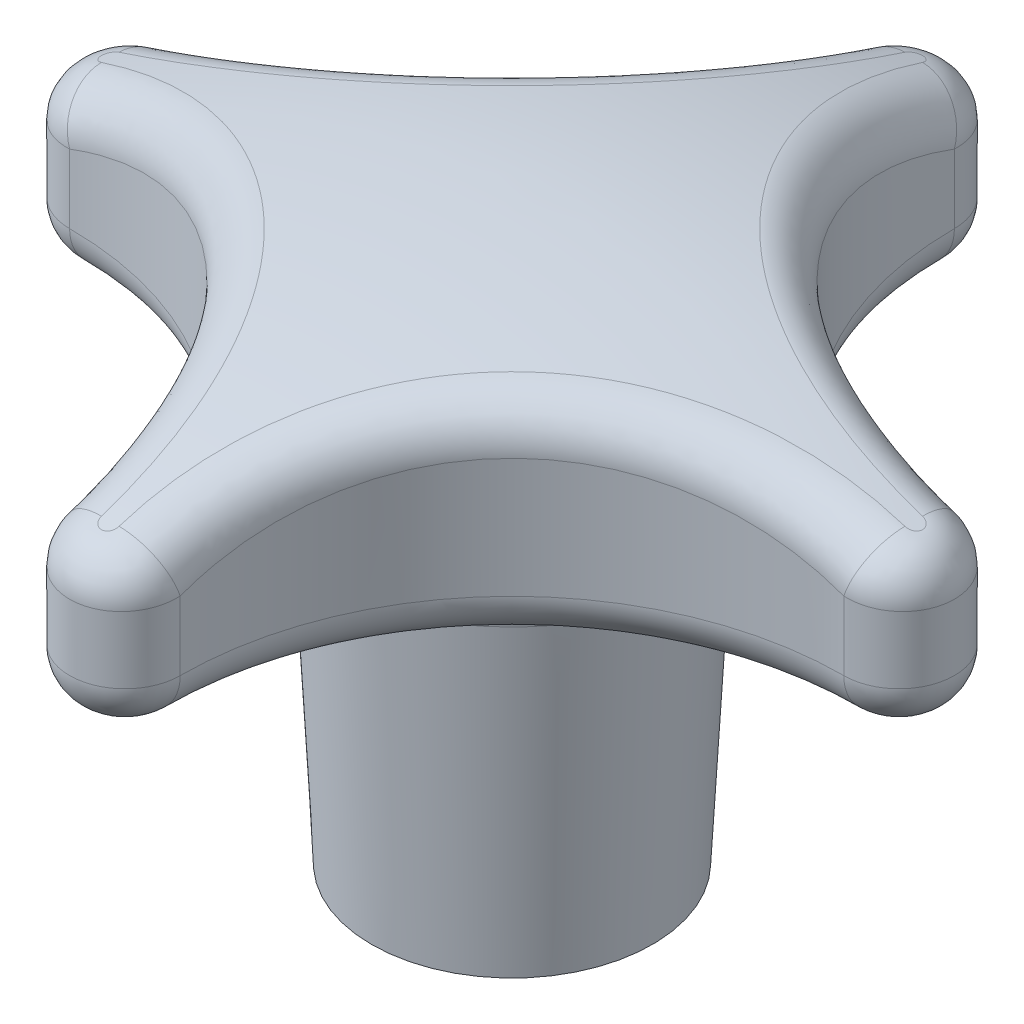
SolidWorks part; units mm, degrees
ref_plane "Front Plane" through (0, 0, 0) normal (0, 0, 1) x (1, 0, 0)
ref_plane "Top Plane" through (0, 0, 0) normal (0, 1, 0) x (1, 0, 0)
ref_plane "Right Plane" through (0, 0, 0) normal (1, 0, 0) x (0, 0, -1)
sketch "Sketch1" plane through (0, 0, 0) normal (0, 1, 0) x (1, 0, 0)
  circle A0 centre (0, 0) radius 10
  dimension "D1" = 20
extrude "Extrude1" add sketch "Sketch1" against normal blind 24
draft "Draft1" type of draft neutral plane draft angle 3 faces to draft 1 parameters "D1"=3
sketch "Sketch2" plane through (0, 0, 0) normal (0, 0, 1) x (1, 0, 0)
  line L0 (0, 0) -> (-31.5, 0)
  line L1 (-31.5, 0) -> (-31.5, 10.4)
  line L2 (0, 0) -> (0, 50000) construction
  line L3 (0, 16) -> (20.2547, 16) construction
  line L4 (0, 0) -> (0, 16)
  arc A0 (0, 16) -> (-31.5, 10.4) centre (0, -75.3937) ccw
revolve "Revolve1" add sketch "Sketch2" angle 360 about L2
sketch "Sketch4" plane through (0, 0, 0) normal (0, 1, 0) x (1, 0, 0)
  line L0 (0, 0) -> (-50000, 0) construction
  line L1 (0, 0) -> (0, 50000) construction
  line L2 (-27.5625, 3.9375) -> (-45.9117, 3.9375) construction
  line L3 (-3.9375, 27.5625) -> (-3.9375, 40.3224) construction
  arc A0 (0, 31.5) -> (-3.9375, 27.5625) centre (0, 27.5625) ccw
  arc A1 (-27.5625, 3.9375) -> (-31.5, 0) centre (-27.5625, 0) ccw
  circle A2 centre (0, 0) radius 31.5 construction
  arc A3 (-27.5625, 3.9375) -> (-3.9375, 27.5625) centre (-27.5625, 27.5625) ccw
  arc A4 (0, 31.5) -> (-31.5, 0) centre (-31.5, 31.5) ccw
  point P9 (0, 31.5)
  point P10 (-31.5, 0)
  point P13 (-3.9375, 27.5625)
  point P14 (-27.5625, 3.9375)
extrude "Extrude3" cut sketch "Sketch4" along normal through all
pattern_circular "CirPattern1" count 4 over 360 about axis through (0, 0, 0) along (0, 1, 0) of "Extrude3"
fillet "Fillet2" radius 3.3333 16 edges at (0, 0, 31.5) (10.8571, 0, 10.8571) (31.5, 0, 0) (10.8571, 0, -10.8571) (0, 0, -31.5) (-10.8571, 0, -10.8571) (-31.5, 0, 0) (-0.0002, 10.4, 31.5) (13.2545, 14.6082, 8.763) (31.5, 10.4, 0.0002) (8.763, 14.6082, -13.2545) (0.0002, 10.4, -31.5) (-13.2545, 14.6082, -8.763) (-31.5, 10.4, 0.0002) (-10.8571, 0, 10.8571) (-8.763, 14.6082, 13.2545)
fillet "Fillet3" radius 1.6667 1 edges at (0, 0, 11.2578)
sketch "Sketch6" plane through (0, -24, 0) normal (0, -1, 0) x (1, 0, 0)
  circle A0 centre (0, 0) radius 6
  dimension "D1" = 12
extrude "Extrude5" cut sketch "Sketch6" against normal blind 25
sketch "Sketch7" plane through (0, 0, 0) normal (0, 0, 1) x (1, 0, 0)
  line L0 (0, 1) -> (6, 1)
  line L1 (6, -24) -> (6, 1) construction
  line L2 (6, 1) -> (0, 4.4641)
  line L3 (0, 4.4641) -> (0, 1)
  line L4 (-6, -24) -> (6, -24) construction
revolve "Cut-Revolve1" cut sketch "Sketch7" angle 360 about L3
sketch "Sketch8" [suppressed] plane through (0, -24, 0) normal (0, -1, 0) x (1, 0, 0)
  circle A0 centre (0, 0) radius 6
  dimension "D1" = 8
extrude "Extrude6" [suppressed] cut sketch "Sketch8" against normal blind 28
sketch "Sketch9" [suppressed] plane through (0, -4, 0) normal (0, -1, 0) x (1, 0, 0)
  circle A0 centre (0, 0) radius 6.5
  dimension "D1" = 8.4
extrude "Extrude7" [suppressed] cut sketch "Sketch9" against normal through all
sketch "Sketch10" [suppressed] plane through (0, -24, 0) normal (0, -1, 0) x (1, 0, 0)
  circle A0 centre (0, 0) radius 6
extrude "Extrude8" [suppressed] cut sketch "Sketch10" against normal blind 22
sketch "Sketch11" [suppressed] plane through (0, 0, 0) normal (0, 0, 1) x (1, 0, 0)
  line L0 (5.1, 7.0555) -> (5.1, -2)
  line L1 (0, 0) -> (0, -5.4531) construction
  line L2 (5.1, 7.0555) -> (0, 10)
  line L3 (0, 10) -> (0, -2)
  line L4 (-6, -2) -> (6, -2) construction
  line L5 (5.1, -2) -> (0, -2)
revolve "Cut-Revolve2" [suppressed] cut sketch "Sketch11" angle 360 about L3
equation "\"D2@Sketch2\" = \"D1@Sketch2\"*.65"
equation "\"D1@Sketch4\" = (\"D3@Sketch2\"*2)/8"
equation "\"D2@Sketch4\" =( \"D3@Sketch2\"*2)/8"
equation "\"D1@Sketch7\" = \"D1@Extrude5\""
equation "\"D1@Fillet3\" = \"D1@Fillet2\"/2"
equation "\"D2@Sketch11\" = \"D1@Sketch10\""
